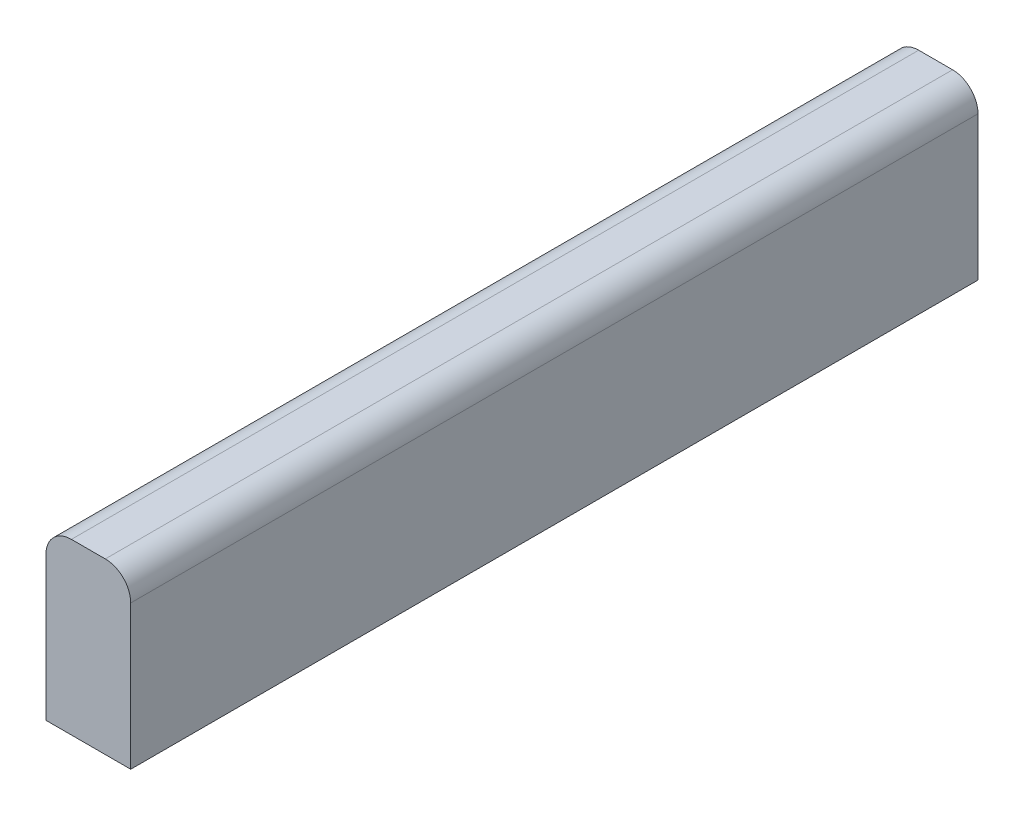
SolidWorks part; units mm, degrees
ref_plane "Ebene vorne" through (0, 0, 0) normal (0, 0, 1) x (1, 0, 0)
ref_plane "Ebene oben" through (0, 0, 0) normal (0, 1, 0) x (1, 0, 0)
ref_plane "Ebene rechts" through (0, 0, 0) normal (1, 0, 0) x (0, 0, -1)
sketch "Skizze1" plane through (0, 0, 0) normal (0, 0, 1) x (1, 0, 0)
  line L1 (0, 0) -> (10, 0)
  line L2 (0, 0) -> (0, 17)
  line L3 (3, 20) -> (7, 20)
  line L4 (10, 0) -> (10, 17)
  arc A0 (0, 17) -> (3, 20) centre (3, 17) cw
  arc A1 (10, 17) -> (7, 20) centre (7, 17) ccw
  point P7 (0, 20)
  dimension "D3" = 3
  dimension "D1" = 10
  dimension "D2" = 20
extrude "Linear austragen1" add sketch "Skizze1" along normal blind 100
